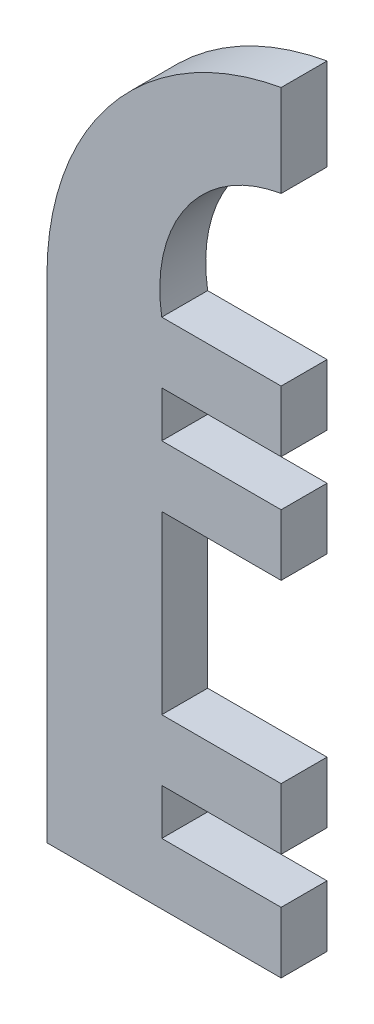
SolidWorks part; units mm, degrees
ref_plane "Alzado" through (0, 0, 0) normal (0, 0, 1) x (1, 0, 0)
ref_plane "Planta" through (0, 0, 0) normal (0, 1, 0) x (1, 0, 0)
ref_plane "Vista lateral" through (0, 0, 0) normal (1, 0, 0) x (0, 0, -1)
sketch "Sketch1" plane through (0, 0, 0) normal (0, 0, 1) x (1, 0, 0)
  line L0 (0, 0) -> (0, 4)
  line L1 (0, 0) -> (-15.3, 0)
  line L2 (0, 7) -> (0, 11)
  line L3 (0, 7) -> (-7.8, 7)
  line L4 (-7.8, 7) -> (-7.8, 4)
  line L5 (-7.8, 4) -> (0, 4)
  line L6 (0, 11) -> (-7.8, 11)
  line L7 (-7.8, 11) -> (-7.8, 22.5)
  line L8 (-7.8, 22.5) -> (0, 22.5)
  line L9 (0, 22.5) -> (0, 26.5)
  line L10 (0, 29.5) -> (0, 33.5)
  line L11 (0, 29.5) -> (-7.8, 29.5)
  line L12 (-7.8, 29.5) -> (-7.8, 26.5)
  line L13 (-7.8, 26.5) -> (0, 26.5)
  line L14 (0, 33.5) -> (-7.8, 33.5)
  line L15 (-15.3, 0) -> (-15.3, 32.1401)
  line L16 (0, 44.3959) -> (0, 50.3959)
  arc A0 (-7.8, 33.5) -> (0, 44.3959) centre (1.5479, 35.0479) cw
  arc A1 (-15.3, 32.1401) -> (0, 50.3959) centre (3.2413, 32.1401) cw
  point P14 (0, 44.3959)
  point P23 (0, 0)
  point P24 (0, 0)
  dimension "D14" = 9.4752
  dimension "D16" = 18.5413
  dimension "D1" = 4
  dimension "D2" = 15.3
  dimension "D3" = 4
  dimension "D4" = 3
  dimension "D5" = 7.8
  dimension "D6" = 11.5
  dimension "D7" = 4
  dimension "D8" = 4
  dimension "D9" = 3
  dimension "D10" = 4
  dimension "D11" = 17.3519
  dimension "D12" = 13.4
  dimension "D13" = 0
  dimension "D15" = 6
  dimension "D17" = 16.8959
  dimension "D18" = 10.8959
extrude "Boss-Extrude1" add sketch "Sketch1" along normal blind 3
